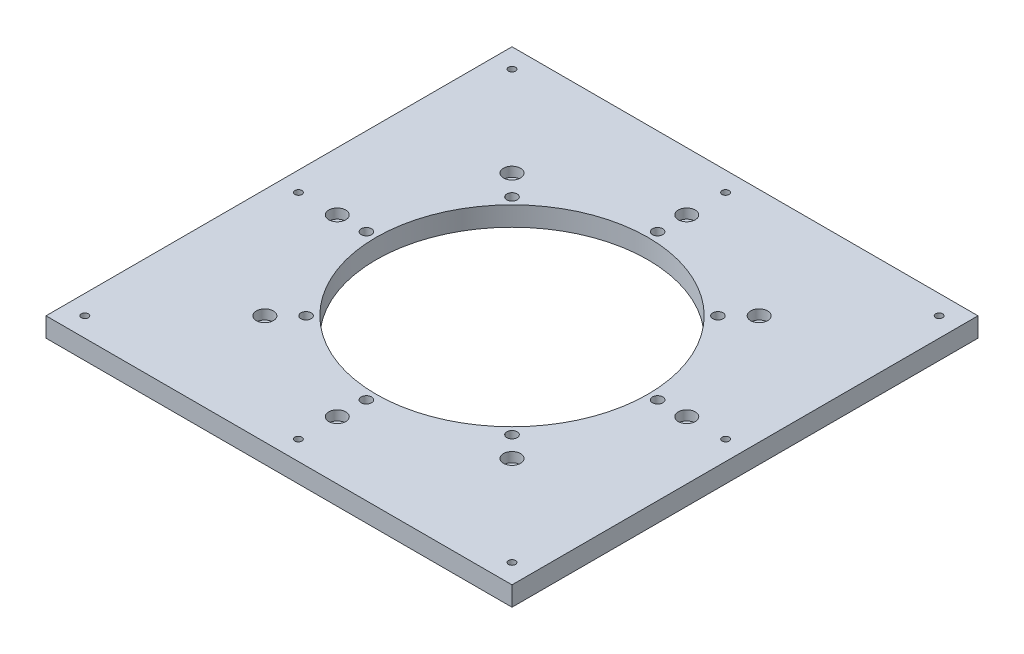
SolidWorks part; units mm, degrees
ref_plane "Front Plane" through (0, 0, 0) normal (0, 0, 1) x (1, 0, 0)
ref_plane "Top Plane" through (0, 0, 0) normal (0, 1, 0) x (1, 0, 0)
ref_plane "Right Plane" through (0, 0, 0) normal (1, 0, 0) x (0, 0, -1)
sketch "Sketch2" plane through (0, 0, 0) normal (0, 1, 0) x (1, 0, 0)
  line L1 (0, 0) -> (-304.8, 0)
  line L2 (0, 0) -> (0, -304.8)
  line L3 (0, -304.8) -> (-304.8, -304.8)
  line L4 (-304.8, 0) -> (-304.8, -304.8)
  dimension "D1" = 304.8
  dimension "D2" = 304.8
extrude "Boss-Extrude1" add sketch "Sketch2" along normal blind 12.7
sketch "Sketch3" plane through (0, 12.7, 0) normal (0, 1, 0) x (1, 0, 0)
  line L0 (0, -304.8) -> (0, 0) construction
  line L1 (0, 0) -> (-304.8, 0) construction
  circle A0 centre (-152.4, -152.4) radius 88.9
  dimension "D1" = 177.8
  dimension "D2" = 152.4
  dimension "D3" = 152.4
extrude "Cut-Extrude1" cut sketch "Sketch3" against normal through all
hole_wizard "CBORE for 1/4 Socket Head Cap Screw2" positions "Sketch6" profile "Sketch7" counterbore size "1/4" standard "ANSI Inch"
sketch "Sketch6" plane through (0, 12.7, 0) normal (0, 1, 0) x (1, 0, 0)
  circle A0 centre (-152.4, -152.4) radius 88.9 construction
  point P0 (-152.4, -38.1)
  dimension "D1" = 114.3
sketch "Sketch7" plane through (-152.4, 12.7, 38.1) normal (1, 0, 0) x (0, 0, 1)
  line L0 (0, 0) -> (0, 25.9312)
  line L1 (0, 25.9312) -> (3.3782, 23.9014)
  line L2 (3.3782, 23.9014) -> (3.3782, 6.35)
  line L3 (3.3782, 6.35) -> (5.5562, 6.35)
  line L4 (5.5562, 6.35) -> (5.5562, 0)
  line L5 (5.5562, 0) -> (0, 0)
  line L10 (0, 25.9312) -> (-3.3782, 23.9014) construction
  line L11 (0, -6.35) -> (0, 107.95) construction
  dimension "Hole Dia." = 6.7564
  dimension "Hole Depth" = 23.9014
  dimension "C'Bore Dia." = 11.1125
  dimension "C'Bore Depth" = 6.35
  dimension "Drill Angle" = 118
pattern_circular "CirPattern2" count 8 over 360 about axis through (-152.4, 0, 152.4) along (0, 1, 0) of "CBORE for 1/4 Socket Head Cap Screw2"
hole_wizard "CBORE for 1/4 Socket Head Cap Screw3" positions "Sketch8" profile "Sketch9" counterbore size "1/4" standard "ANSI Inch"
sketch "Sketch8" plane through (0, 0, 0) normal (0, -1, 0) x (-1, 0, 0)
  circle A0 centre (152.4, -152.4) radius 88.9 construction
  point P0 (152.4, -57.15)
  dimension "D1" = 95.25
sketch "Sketch9" plane through (-152.4, 0, 57.15) normal (1, 0, 0) x (0, 0, -1)
  line L0 (0, 0) -> (0, 25.9312)
  line L1 (0, 25.9312) -> (3.3782, 23.9014)
  line L2 (3.3782, 23.9014) -> (3.3782, 6.35)
  line L3 (3.3782, 6.35) -> (5.5562, 6.35)
  line L4 (5.5562, 6.35) -> (5.5562, 0)
  line L5 (5.5562, 0) -> (0, 0)
  line L10 (0, 25.9312) -> (-3.3782, 23.9014) construction
  line L11 (0, -6.35) -> (0, 107.95) construction
  dimension "Hole Dia." = 6.7564
  dimension "Hole Depth" = 23.9014
  dimension "C'Bore Dia." = 11.1125
  dimension "C'Bore Depth" = 6.35
  dimension "Drill Angle" = 118
pattern_circular "CirPattern3" count 8 over 360 about axis through (-152.4, 0, 152.4) along (0, 1, 0) of "CBORE for 1/4 Socket Head Cap Screw3"
hole_wizard "CBORE for 1/4 Socket Head Cap Screw5" positions "Sketch12" profile "Sketch13" counterbore size "1/4" standard "ANSI Inch"
sketch "Sketch12" plane through (0, 0, 0) normal (0, -1, 0) x (-1, 0, 0)
  line L0 (304.8, -304.8) -> (0, -304.8) construction
  line L1 (304.8, 0) -> (304.8, -304.8) construction
  line L2 (0, -304.8) -> (0, 0) construction
  line L3 (0, 0) -> (304.8, 0) construction
  point P0 (292.1, -292.1)
  point P2 (152.4, -292.1)
  point P4 (12.7, -292.1)
  point P6 (12.7, -152.4)
  point P8 (12.7, -12.7)
  dimension "D1" = 12.7
  dimension "D2" = 12.7
  dimension "D3" = 12.7
  dimension "D4" = 152.4
  dimension "D5" = 12.7
  dimension "D6" = 12.7
  dimension "D7" = 12.7
  dimension "D8" = 152.4
  dimension "D9" = 12.7
  dimension "D10" = 12.7
sketch "Sketch13" plane through (-292.1, 0, 292.1) normal (1, 0, 0) x (0, 0, -1)
  line L0 (0, 0) -> (0, 14.0694)
  line L1 (0, 14.0694) -> (3.3782, 12.0396)
  line L2 (3.3782, 12.0396) -> (3.3782, 6.35)
  line L3 (3.3782, 6.35) -> (5.5562, 6.35)
  line L4 (5.5562, 6.35) -> (5.5562, 0)
  line L5 (5.5562, 0) -> (0, 0)
  line L10 (0, 14.0694) -> (-3.3782, 12.0396) construction
  line L11 (0, -6.35) -> (0, 107.95) construction
  dimension "Hole Dia." = 6.7564
  dimension "Hole Depth" = 12.0396
  dimension "C'Bore Dia." = 11.1125
  dimension "C'Bore Depth" = 6.35
  dimension "Drill Angle" = 118
hole_wizard "CBORE for 1/4 Socket Head Cap Screw6" positions "Sketch14" profile "Sketch15" counterbore size "1/4" standard "ANSI Inch"
sketch "Sketch14" plane through (0, 0, 0) normal (0, -1, 0) x (-1, 0, 0)
  line L0 (304.8, 0) -> (304.8, -304.8) construction
  line L1 (0, 0) -> (304.8, 0) construction
  line L2 (0, -304.8) -> (0, 0) construction
  point P0 (292.1, -152.4)
  point P2 (292.1, -12.7)
  point P4 (152.4, -12.7)
  dimension "D1" = 12.7
  dimension "D2" = 152.4
  dimension "D3" = 12.7
  dimension "D4" = 12.7
  dimension "D5" = 12.7
  dimension "D6" = 152.4
sketch "Sketch15" plane through (-292.1, 0, 152.4) normal (1, 0, 0) x (0, 0, -1)
  line L0 (0, 0) -> (0, 14.0694)
  line L1 (0, 14.0694) -> (3.3782, 12.0396)
  line L2 (3.3782, 12.0396) -> (3.3782, 6.35)
  line L3 (3.3782, 6.35) -> (5.5562, 6.35)
  line L4 (5.5562, 6.35) -> (5.5562, 0)
  line L5 (5.5562, 0) -> (0, 0)
  line L10 (0, 14.0694) -> (-3.3782, 12.0396) construction
  line L11 (0, -6.35) -> (0, 107.95) construction
  dimension "Hole Dia." = 6.7564
  dimension "Hole Depth" = 12.0396
  dimension "C'Bore Dia." = 11.1125
  dimension "C'Bore Depth" = 6.35
  dimension "Drill Angle" = 118
